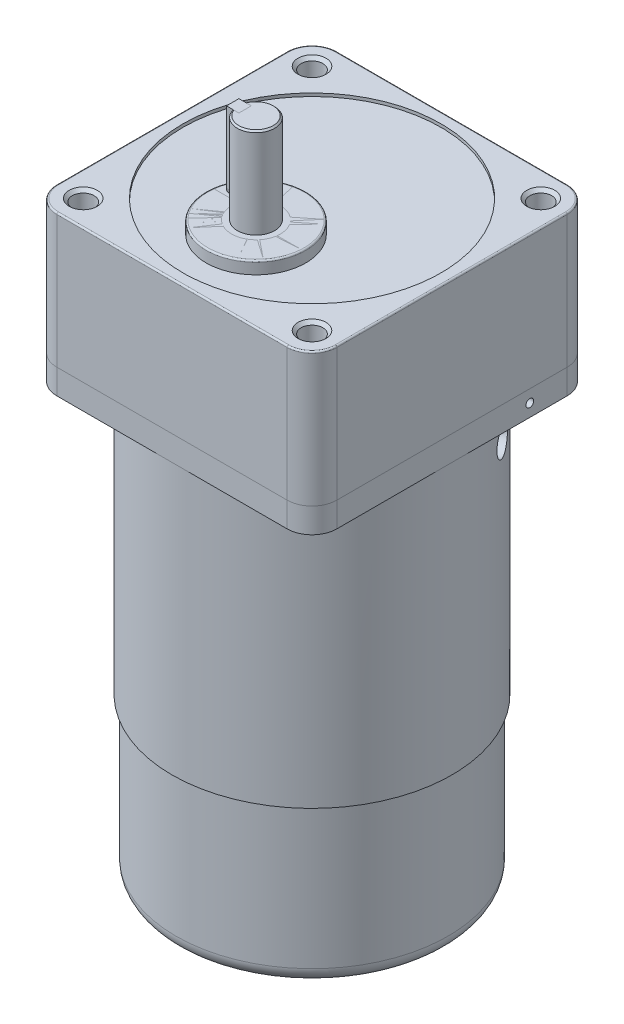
SolidWorks part; units mm, degrees
ref_plane "前视基准面" through (0, 0, 0) normal (0, 0, 1) x (1, 0, 0)
ref_plane "上视基准面" through (0, 0, 0) normal (0, 1, 0) x (1, 0, 0)
ref_plane "右视基准面" through (0, 0, 0) normal (1, 0, 0) x (0, 0, -1)
imported_body "复件 (4) 51k40cc-00机壳 9024.0040.106-00-1-surface1"
imported_body "复件 (4) 51k40cc-00机壳 9024.0040.106-00-1-surface2"
imported_body "9050.0018.101.01箱体-1-surface1"
imported_body "9050.0018.101.01箱体-1-surface2"
imported_body "9050.0018.101.01箱体-1-surface3"
imported_body "9050.0018.101.01箱体-1-surface4"
imported_body "9050.0018.101.01箱体-1-surface5"
imported_body "9050.0018.101.01箱体-1-surface6"
sketch "草图1" plane through (0, 112.0099, 0) normal (0, 1, 0) x (1, 0, 0)
  circle A0 centre (9.4117, -18) radius 16
extrude "凸台-拉伸1" add sketch "草图1" along normal blind 4
fillet "圆角1" radius 0.5 1 edges at (-6.5883, 116.0099, 18)
sketch "草图2" plane through (0, 116.0099, 0) normal (0, 1, 0) x (1, 0, 0)
  circle A0 centre (9.4117, -18) radius 6
extrude "凸台-拉伸2" add sketch "草图2" along normal blind 29
ref_plane "基准面1" through (3.4117, 0, 0) normal (1, 0, 0) x (0, 0, -1)
sketch "草图3" plane through (3.4117, 0, 0) normal (1, 0, 0) x (0, 0, -1)
  line L1 (-12, 145.0099) -> (-24, 145.0099) construction
  line L2 (-16, 122.0099) -> (-16, 145.0099)
  line L3 (-16, 145.0099) -> (-20, 145.0099)
  line L4 (-20, 145.0099) -> (-20, 122.0099)
  arc A0 (-20, 122.0099) -> (-16, 122.0099) centre (-18, 122.0099) ccw
extrude "切除-拉伸1" cut sketch "草图3" along normal blind 2.5
sketch "草图4" plane through (5.9117, 0, 0) normal (-1, 0, 0) x (0, 0, 1)
  line L0 (16, 122.0099) -> (16, 145.0099)
  line L1 (16, 145.0099) -> (20, 145.0099)
  line L2 (20, 145.0099) -> (20, 122.0099)
  arc A0 (16, 122.0099) -> (20, 122.0099) centre (18, 122.0099) ccw
extrude "凸台-拉伸3" add sketch "草图4" along normal blind 4 separate body
chamfer "倒角1" distance 0.5 angle 45 1 edges at (15.4117, 145.0099, 18)
